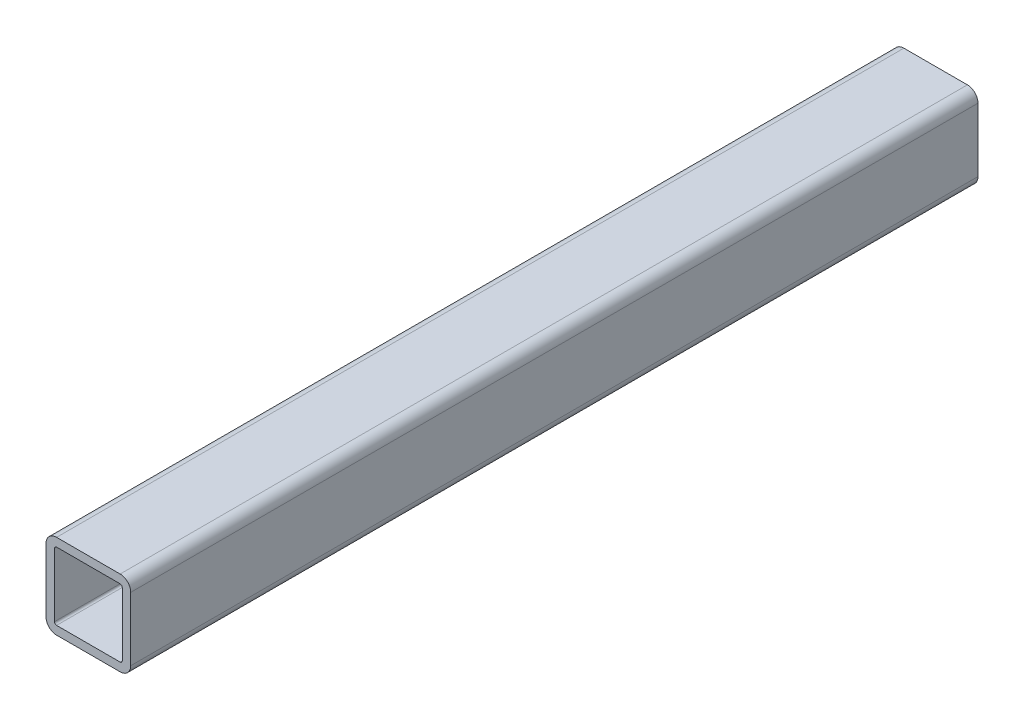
SolidWorks part; units mm, degrees
ref_plane "Face" through (0, 0, 0) normal (0, 0, 1) x (1, 0, 0)
ref_plane "Dessus" through (0, 0, 0) normal (0, 1, 0) x (1, 0, 0)
ref_plane "Droite" through (0, 0, 0) normal (1, 0, 0) x (0, 0, -1)
sketch "Esquisse1" plane through (0, 0, 0) normal (0, 0, 1) x (1, 0, 0)
  line L0 (5, -4) -> (35, -4)
  line L1 (5, 0) -> (35, 0)
  line L2 (0, -5) -> (0, -35)
  line L3 (5, -40) -> (35, -40)
  line L4 (40, -5) -> (40, -35)
  line L5 (36, -5) -> (36, -35)
  line L6 (5, -36) -> (35, -36)
  line L7 (4, -5) -> (4, -35)
  arc A0 (35, -40) -> (40, -35) centre (35, -35) ccw
  arc A1 (0, -35) -> (5, -40) centre (5, -35) ccw
  arc A2 (5, 0) -> (0, -5) centre (5, -5) ccw
  arc A3 (35, 0) -> (40, -5) centre (35, -5) cw
  arc A4 (35, -4) -> (36, -5) centre (35, -5) cw
  arc A5 (35, -36) -> (36, -35) centre (35, -35) ccw
  arc A6 (4, -35) -> (5, -36) centre (5, -35) ccw
  arc A7 (5, -4) -> (4, -5) centre (5, -5) ccw
  point P9 (0, -40)
  point P12 (0, 0)
  point P15 (40, 0)
  dimension "D3" = 5
  dimension "D4" = 5
  dimension "D1" = 40
  dimension "D2" = 40
  dimension "D5" = 4
extrude "Base-Extrusion" add sketch "Esquisse1" along normal blind 400
